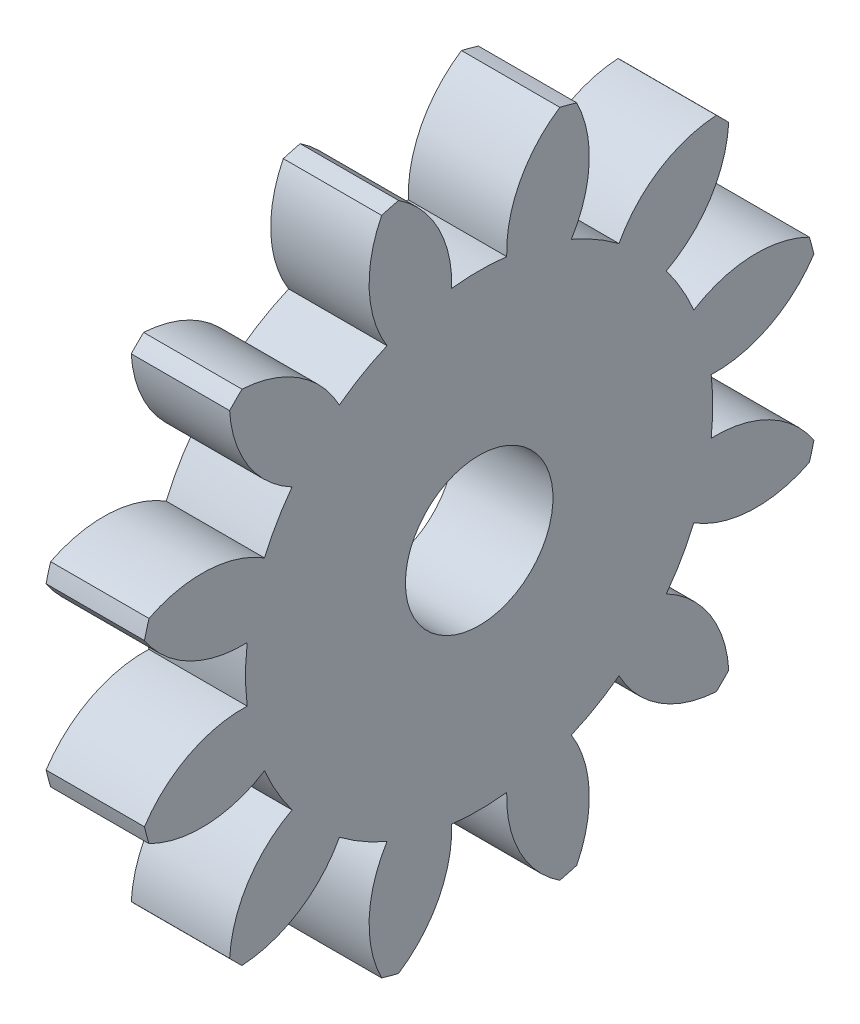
SolidWorks part; units mm, degrees
ref_plane "Plane1" through (0, 0, 0) normal (0, 0, 1) x (1, 0, 0)
ref_plane "Plane2" through (0, 0, 0) normal (0, 1, 0) x (1, 0, 0)
ref_plane "Plane3" through (0, 0, 0) normal (1, 0, 0) x (0, 0, -1)
sketch "HoldingSke" plane through (0, 0, 0) normal (0, 1, 0) x (1, 0, 0)
  line L0 (0, 0) -> (98.996, -22.855)
  line L1 (-15, 0) -> (100, 0) construction
  line L2 (0, 0) -> (-2.1039, 2.3779)
  line L3 (0, 0) -> (-11.863, 4.5341)
  line L4 (0, 0) -> (8.4473, 1.7955)
  line L5 (0, 0) -> (-23.7986, -8.8762)
  line L6 (0, 0) -> (-10.5278, -7.1032)
  line L7 (-2.1039, 2.3779) -> (3.3635, 27.1825)
  line L8 (-76.2, 54.61) -> (-54.61, 54.61)
  line L9 (-71.009, 38.7566) -> (-53.1078, 45.2721)
  line L10 (-76.2, 71.12) -> (104.1128, 71.12)
  line L11 (0, 0) -> (-12.7, 0)
  line L12 (-76.2, 101.6) -> (-75.9714, 101.6)
  line L13 (24.9733, 27.94) -> (52.9518, 28.4284)
  line L14 (24.9733, 27.94) -> (24.9746, 27.94)
  line L15 (24.9733, 27.94) -> (100.4006, 29.5858)
  circle A0 centre (0, 0) radius 9.525
  circle A1 centre (0, 0) radius 12.7
  circle A2 centre (0, 0) radius 12.7
  circle A3 centre (0, 0) radius 9.525
  dimension "MHD" = 25.4
  dimension "Hub_dia" = 25.4
  dimension "Bore" = 19.05
  dimension "MBD" = 19.05
  dimension "Num_teeth" = 12
  dimension "Pitch_radius" = 180.3128
  dimension "Pitch" = 101.6
  dimension "Width" = 12.7
  dimension "Overall_len" = 25.4
  dimension "Show_teeth" = 13
  dimension "Thickness" = 12.7
  dimension "OAL" = 25.4001
  dimension "T_dim" = 21.59
  dimension "Ap" = 20
  dimension "H" = 19.05
  dimension "Backlash" = 0.2286
  dimension "Addendum_fac" = 1
  dimension "Dedendum_fac" = 1.25
  dimension "Clearance_fac" = 0.25
  dimension "Dedendum_add" = 0.0013
sketch "BasProSke" plane through (0, 0, 0) normal (0, 1, 0) x (1, 0, 0)
  line L0 (-10, 0) -> (60, 0) construction
  line L1 (0, 0) -> (0, 44.45)
  line L2 (0, 0) -> (12.7, 0)
  line L3 (12.7, 0) -> (12.7, 44.45)
  line L4 (12.7, 44.45) -> (0, 44.45)
  dimension "Diameter" = 88.9
  dimension "Thickness" = 12.7
revolve "Base-Revolve" add sketch "BasProSke" angle 360 about L0
sketch "TooCutSke" plane through (0, 0, 0) normal (1, 0, 0) x (0, 0, -1)
  line L1 (0, 0) -> (0, 107) construction
  line L2 (0, 0) -> (-5.3725, 37.7193) construction
  line L3 (0, 0) -> (-19.5794, 73.0714) construction
  line L4 (-5.3725, 37.7193) -> (-9.7897, 36.5357) construction
  arc A0 (3.5522, 29.9513) -> (-3.5522, 29.9513) centre (0, 0) ccw
  arc A1 (10.4397, 43.2328) -> (-10.4397, 43.2328) centre (0, 0) ccw
  circle A2 centre (0, 0) radius 38.1 construction
  circle A3 centre (0, 0) radius 35.8023 construction
  arc A4 (-3.5522, 29.9513) -> (-10.4397, 43.2328) centre (-18.7831, 30.4795) ccw
  arc A5 (10.4397, 43.2328) -> (3.5522, 29.9513) centre (18.7831, 30.4795) ccw
  dimension "Root_dia" = 60.3225
  dimension "Overcut_dia" = 88.9508
  dimension "Pitch_dia" = 76.2
  dimension "Base_dia" = 71.6046
  dimension "Flank_rad" = 15.24
  dimension "Half_ang" = 15
  dimension "Half_CT" = 4.573
extrude "ToothCut" cut sketch "TooCutSke" along normal through all
fillet "Breaks" [suppressed] radius 0.127
fillet "RootFillets" [suppressed] radius 1.5888
pattern_circular "TeethCuts" count 12 every 30 about axis through (-10, 0, 0) along (1, 0, 0) of "ToothCut", "RootFillets", "Breaks"
sketch "HubNeaOneSke" plane through (0, 0, 0) normal (-1, 0, 0) x (0, 0, 1)
  circle A0 centre (0, 0) radius 12.7
  dimension "Diameter" = 25.4
extrude "HubNearOne" [suppressed] add sketch "HubNeaOneSke" along normal blind 12.7001
sketch "HubNeaBotSke" plane through (0, 0, 0) normal (-1, 0, 0) x (0, 0, 1)
  circle A0 centre (0, 0) radius 12.7
  dimension "Diameter" = 25.4
extrude "HubNearBoth" [suppressed] add sketch "HubNeaBotSke" along normal blind 6.35
ref_plane "FarPln" through (12.7, 0, 0) normal (1, 0, 0) x (0, 0, -1)
sketch "HubFarSke" plane through (12.7, 0, 0) normal (1, 0, 0) x (0, 0, -1)
  circle A0 centre (0, 0) radius 12.7
  dimension "Diameter" = 25.4
extrude "HubFar" [suppressed] add sketch "HubFarSke" along normal blind 6.35
sketch "BorSke" plane through (0, 0, 0) normal (1, 0, 0) x (0, 0, -1)
  circle A0 centre (0, 0) radius 9.525
  dimension "Diameter" = 19.05
extrude "Bore" cut sketch "BorSke" along normal mid plane 50.8001
sketch "KeySke" plane through (0, 0, 0) normal (1, 0, 0) x (0, 0, -1)
  line L0 (-3.175, 0) -> (-3.175, 12.065)
  line L1 (-3.175, 12.065) -> (3.175, 12.065)
  line L2 (3.175, 12.065) -> (3.175, 0)
  line L3 (0, 0) -> (0, 34) construction
  line L4 (-3.175, 0) -> (3.175, 0)
  dimension "Offset" = 12.065
  dimension "Width" = 6.35
extrude "Keyway" [suppressed] cut sketch "KeySke" along normal mid plane 50.8001
pattern_circular "Keyway2" [suppressed] count 2 every 90 about axis through (-10, 0, 0) along (1, 0, 0)
equation "' \"Pitch@HoldingSke\" = 4"
equation "' \"Num_teeth@HoldingSke\" = 12"
equation "' \"Ap@HoldingSke\" =  20"
equation "' \"Width@HoldingSke\" = 0.5"
equation "' \"Hub_dia@HoldingSke\"= 1"
equation "' \"Overall_len@HoldingSke\" = 1.0"
equation "' \"Bore@HoldingSke\" = 0.75"
equation "' \"T_dim@HoldingSke\" = 0.85"
equation "' \"Width@KeySke\" = 0.25"
equation "' \"Show_teeth@HoldingSke\" = 13"
equation "' \"Backlash@HoldingSke\" = 0.009"
equation "' \"Addendum_fac@HoldingSke\" = 1.0"
equation "' \"Dedendum_fac@HoldingSke\" = 1.25"
equation "' \"Dedendum_add@HoldingSke\" = 0.00005"
equation "' \"Clearance_fac@HoldingSke\" = 0.25"
equation "' \"Pitch@HoldingSke\" = 0.5"
equation "' \"Num_teeth@HoldingSke\" = 23"
equation "' \"Show_teeth@HoldingSke\" = 23"
equation "' \"Backlash@HoldingSke\" = 0.0375"
equation "\"Overcut_dia@TooCutSke\" = (\"Num_teeth@HoldingSke\" + 2 * \"Addendum_fac@HoldingSke\") / \"Pitch@HoldingSke\" + 0.002"
equation "\"Pitch_dia@TooCutSke\" = \"Num_teeth@HoldingSke\" / \"Pitch@HoldingSke\""
equation "\"Base_dia@TooCutSke\" = \"Num_teeth@HoldingSke\" / \"Pitch@HoldingSke\" * cos((\"Ap@HoldingSke\"  * 3.14159265 / 180))"
equation "\"Root_dia@TooCutSke\" = (\"Num_teeth@HoldingSke\" + 2) / \"Pitch@HoldingSke\" - 2 * (\"Addendum_fac@HoldingSke\" + \"Dedendum_fac@HoldingSke\") / \"Pitch@HoldingSke\" - \"Dedendum_add@HoldingSke\" * 2"
equation "\"Half_ang@TooCutSke\" = 180 / \"Num_teeth@HoldingSke\""
equation "\"Half_CT@TooCutSke\" = \"Num_teeth@HoldingSke\" / \"Pitch@HoldingSke\" * sin((3.14159265 / 2 / \"Num_teeth@HoldingSke\")) / 2 - 7 * \"Backlash@HoldingSke\" / 4"
equation "\"Flank_rad@TooCutSke\" = \"Num_teeth@HoldingSke\" / \"Pitch@HoldingSke\" / 5"
equation "\"Radius@RootFillets\" = \"Clearance_fac@HoldingSke\" / \"Pitch@HoldingSke\" + \"Dedendum_add@HoldingSke\""
equation "\"Break_rad@Breaks\" = 0.02 / \"Pitch@HoldingSke\""
equation "\"Thickness@HoldingSke\" = \"Width@HoldingSke\""
equation "\"OAL@HoldingSke\" = \"Thickness@HoldingSke\""
equation "\"MHD@HoldingSke\" = (\"Num_teeth@HoldingSke\" + 2) / \"Pitch@HoldingSke\" - 2 * (\"Addendum_fac@HoldingSke\" + \"Dedendum_fac@HoldingSke\")  / \"Pitch@HoldingSke\" - \"Dedendum_add@HoldingSke\" * 2"
equation "\"MBD@HoldingSke\" = (\"Num_teeth@HoldingSke\" + 2) / \"Pitch@HoldingSke\" - 2 * (\"Addendum_fac@HoldingSke\" + \"Dedendum_fac@HoldingSke\")  / \"Pitch@HoldingSke\" - \"Dedendum_add@HoldingSke\" * 2 - 0.002"
equation "\"MHD@HoldingSke\" = ((sgn( \"MHD@HoldingSke\" - \"Hub_dia@HoldingSke\" )-1)*( \"MHD@HoldingSke\" - \"Hub_dia@HoldingSke\" ))/-2+ \"Hub_dia@HoldingSke\""
equation "\"MBD@HoldingSke\" = ((sgn( \"MBD@HoldingSke\" - \"Bore@HoldingSke\" )-1)*( \"MBD@HoldingSke\" - \"Bore@HoldingSke\" ))/-2+ \"Bore@HoldingSke\""
equation "\"OAL@HoldingSke\" = ((sgn( \"OAL@HoldingSke\" - \"Overall_len@HoldingSke\" )+1)*( \"OAL@HoldingSke\" - \"Overall_len@HoldingSke\" ))/2 + \"Overall_len@HoldingSke\" + 0.000002"
equation "\"Num_teeth@TeethCuts\" = int( \"Show_teeth@HoldingSke\" ) + 1"
equation "\"Num_teeth@TeethCuts\" = ((sgn( \"Num_teeth@TeethCuts\" - \"Num_teeth@HoldingSke\" )-1)*( \"Num_teeth@TeethCuts\" - \"Num_teeth@HoldingSke\" ))/-2+ \"Num_teeth@HoldingSke\""
equation "\"Num_teeth@TeethCuts\" = ((sgn( \"Num_teeth@TeethCuts\" - 2.0)+1)*( \"Num_teeth@TeethCuts\" - 2.0))/2 +2.0"
equation "\"Angle@TeethCuts\" = 360.0 / \"Num_teeth@HoldingSke\""
equation "\"Diameter@BasProSke\" = (\"Num_teeth@HoldingSke\" + 2 * \"Addendum_fac@HoldingSke\") / \"Pitch@HoldingSke\""
equation "\"Thickness@BasProSke\"  = \"Thickness@HoldingSke\""
equation "' \"Fillet_rad@BasProSke\" =  \"Thickness@HoldingSke\" * 0.05"
equation "\"MHD@HoldingSke\" = ((sgn( \"MHD@HoldingSke\" - \"Root_dia@TooCutSke\" )-1)*( \"MHD@HoldingSke\" - \"Root_dia@TooCutSke\" ))/-2+ \"Root_dia@TooCutSke\""
equation "\"Diameter@HubNeaOneSke\" = \"MHD@HoldingSke\""
equation "\"Length@HubNearOne\" = \"OAL@HoldingSke\" - \"Thickness@BasProSke\""
equation "\"Diameter@HubNeaBotSke\" = \"MHD@HoldingSke\""
equation "\"Length@HubNearBoth\" = ( \"OAL@HoldingSke\" - \"Thickness@BasProSke\" ) / 2.0"
equation "\"Thickness@FarPln\" = \"Thickness@BasProSke\""
equation "\"Diameter@HubFarSke\" = \"MHD@HoldingSke\""
equation "\"Length@HubFar\" = ( \"OAL@HoldingSke\" - \"Thickness@BasProSke\" ) / 2.0"
equation "\"Diameter@BorSke\" = \"MBD@HoldingSke\""
equation "\"D1@Bore\" = \"OAL@HoldingSke\" * 2.0"
equation "\"D1@Keyway\" = \"OAL@HoldingSke\" * 2.0"
equation "\"Offset@KeySke\" = \"T_dim@HoldingSke\" - \"MBD@HoldingSke\" / 2.0"
